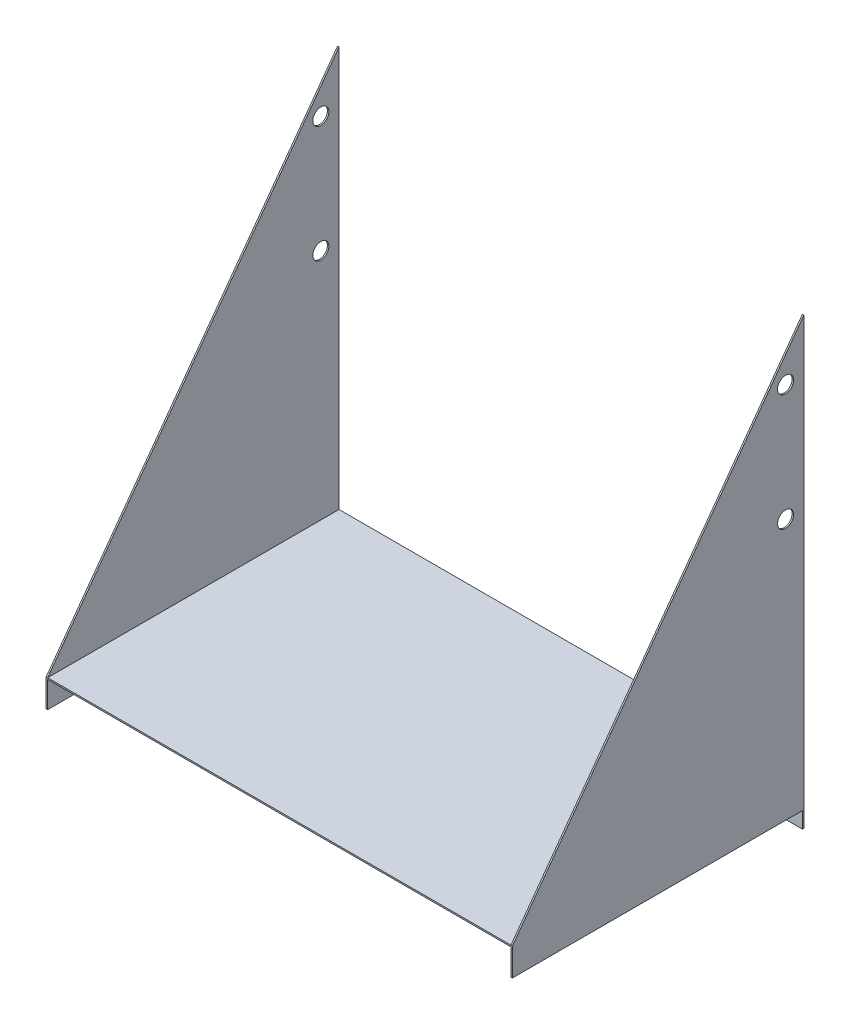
SolidWorks part; units mm, degrees
ref_plane "Plan de face" through (0, 0, 0) normal (0, 0, 1) x (1, 0, 0)
ref_plane "Plan de dessus" through (0, 0, 0) normal (0, 1, 0) x (1, 0, 0)
ref_plane "Plan de droite" through (0, 0, 0) normal (1, 0, 0) x (0, 0, -1)
sketch "Esquisse1" plane through (0, 0, 0) normal (0, 0, 1) x (1, 0, 0)
  line L0 (-52.2651, 0) -> (265.7349, 0)
  line L1 (265.7349, 0) -> (265.7349, -18)
  line L2 (-52.2651, 0) -> (-52.2651, -18)
  dimension "D1" = 318
  dimension "D2" = 18
  dimension "D3" = 18
  dimension "D4" = 52.2651
extrude "Extru.-Mince1" add sketch "Esquisse1" along normal blind 200 thin
sketch "Esquisse2" plane through (266.7349, 0, 0) normal (1, 0, 0) x (0, 0, -1)
  line L0 (0, 1) -> (0, 276)
  line L1 (0, 276) -> (-200, 1)
  line L6 (0, -18) -> (0, 1)
  line L7 (0, 1) -> (-200, 1)
  line L8 (-200, 1) -> (-200, -18)
  line L9 (-200, -18) -> (0, -18)
  line L11 (0, 1) -> (-200, 1)
  dimension "D2" = 275
  dimension "D1" = 0
extrude "Extrusion1" add sketch "Esquisse2" against normal blind 1
sketch "Esquisse3" plane through (-53.2651, 0, 0) normal (-1, 0, 0) x (0, 0, 1)
  line L0 (0, 1) -> (0, 276)
  line L1 (0, 276) -> (200, 1)
  line L2 (0, 276) -> (200, 1) construction
  line L3 (0, 1) -> (0, 276) construction
  line L6 (0, 1) -> (0, -18)
  line L7 (0, -18) -> (200, -18)
  line L8 (200, -18) -> (200, 1)
  line L9 (200, 1) -> (0, 1)
  line L10 (0, 1) -> (0, -18)
  line L11 (0, -18) -> (200, -18)
  line L12 (200, -18) -> (200, 1)
  dimension "D1" = 0
extrude "Extrusion2" add sketch "Esquisse3" against normal blind 1
sketch "Esquisse4" plane through (0, 0, 0) normal (0, 0, -1) x (-1, 0, 0)
  line L0 (-266.7349, -18) -> (-266.7349, 276) construction
  line L1 (-266.7349, 0) -> (-266.7349, -29)
  line L2 (-265.7349, 0) -> (52.2651, 0) construction
  line L3 (-266.7349, 0) -> (53.2651, 0)
  line L4 (53.2651, 0) -> (53.2651, -29)
  line L5 (53.2651, -29) -> (-266.7349, -29)
  line L6 (53.2651, 276) -> (53.2651, -18) construction
  line L7 (-265.7349, 1) -> (52.2651, 1) construction
  dimension "D1" = 30
extrude "Extrusion3" add sketch "Esquisse4" against normal blind 1
sketch "Esquisse5" plane through (266.7349, 0, 0) normal (1, 0, 0) x (0, 0, -1)
  line L0 (-200, 1) -> (0, 1) construction
  line L1 (0, -29) -> (0, 276) construction
  circle A0 centre (-12.5, 241) radius 5.5
  circle A1 centre (-12.5, 161) radius 5.5
  dimension "D3" = 11
  dimension "D4" = 11
  dimension "D1" = 160
  dimension "D2" = 240
  dimension "D5" = 12.5
extrude "Enlèv. mat.-Extru.1" cut sketch "Esquisse5" against normal blind 401
sketch "Esquisse6" plane through (0, 0, 1) normal (0, 0, 1) x (1, 0, 0)
  line L0 (-53.2651, -29) -> (-53.2651, 276) construction
  line L1 (266.7349, 276) -> (266.7349, -29) construction
  line L2 (266.7349, -29) -> (-53.2651, -29) construction
  circle A0 centre (-33.2651, -9) radius 5.5
  circle A1 centre (246.7349, -9) radius 5.5
  point P4 (-53.2651, 123.5)
  point P7 (266.7349, 123.5)
  dimension "D2" = 11
  dimension "D3" = 11
  dimension "D1" = 20
  dimension "D4" = 20
  dimension "D5" = 20
  dimension "D6" = 20
extrude "Enlèv. mat.-Extru.2" cut sketch "Esquisse6" against normal blind 401
